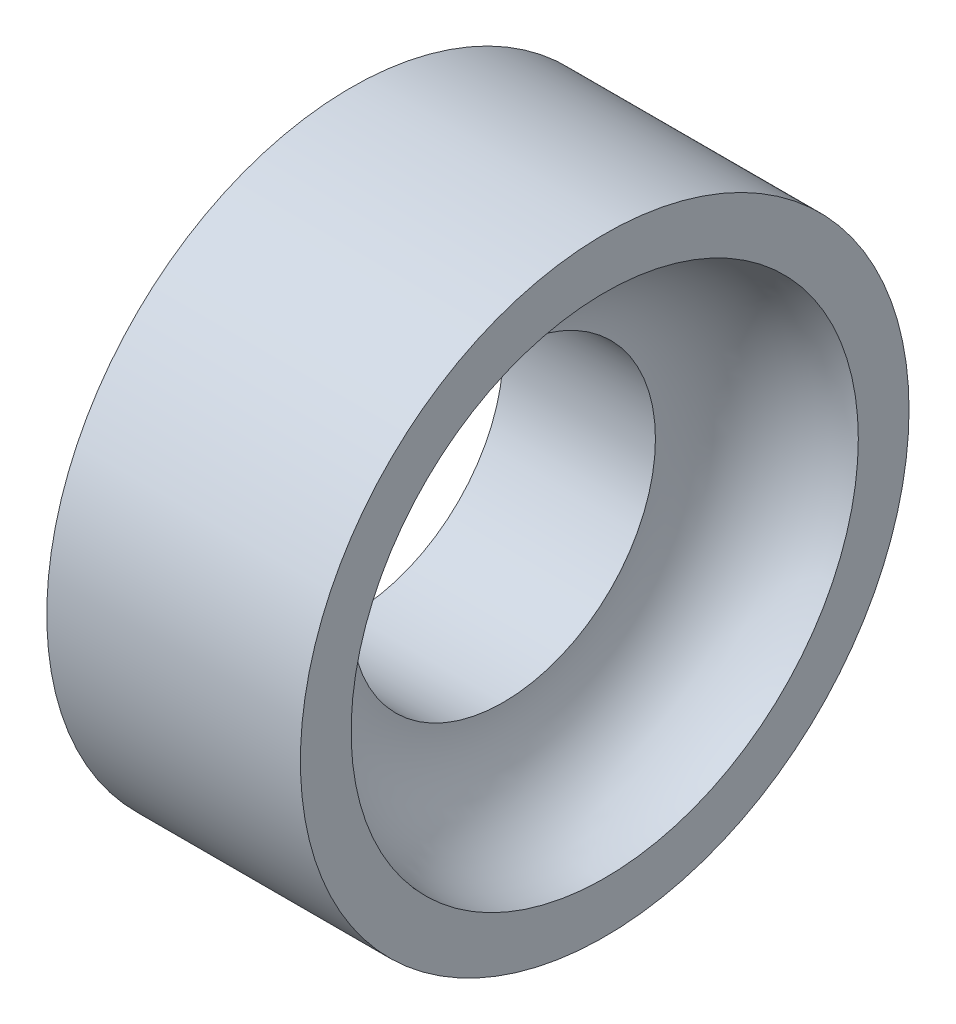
SolidWorks part; units mm, degrees
ref_plane "face" through (0, 0, 0) normal (0, 0, 1) x (1, 0, 0)
ref_plane "dessus" through (0, 0, 0) normal (0, 1, 0) x (1, 0, 0)
ref_plane "droite" through (0, 0, 0) normal (1, 0, 0) x (0, 0, -1)
sketch "Esquisse1" plane through (0, 0, 0) normal (0, 0, 1) x (1, 0, 0)
  line L0 (0, 0) -> (0, -6)
  line L1 (0, -6) -> (-5, -6)
  line L2 (-5, -6) -> (-5, 0)
  line L3 (0, 0) -> (-30, 0) construction
  line L4 (0, 0) -> (-5, 0)
  dimension "D1" = 6
revolve "Base-Révolution" add sketch "Esquisse1" angle 360 about L3
sketch "Esquisse2" plane through (0, 0, 0) normal (1, 0, 0) x (0, 0, -1)
  circle A0 centre (0, 0) radius 3
  dimension "D1" = 6
extrude "Enlèv. mat.-Extru.1" cut sketch "Esquisse2" against normal blind 6
sketch "Esquisse3" plane through (0, 0, 0) normal (0, 0, 1) x (1, 0, 0)
  line L5 (0, 0) -> (-10.2303, 0) construction
  line L8 (-5, 0) -> (0, 0) construction
  line L10 (0, 3) -> (-5, 3) construction
  line L11 (0, -6) -> (0, 6) construction
  line L12 (-2, 3) -> (0, 5)
  arc A0 (-2, 3) -> (0, 5) centre (0, 3) cw
revolve "Enlèvement de matière-Révolution1" cut sketch "Esquisse3" angle 360 about L5
